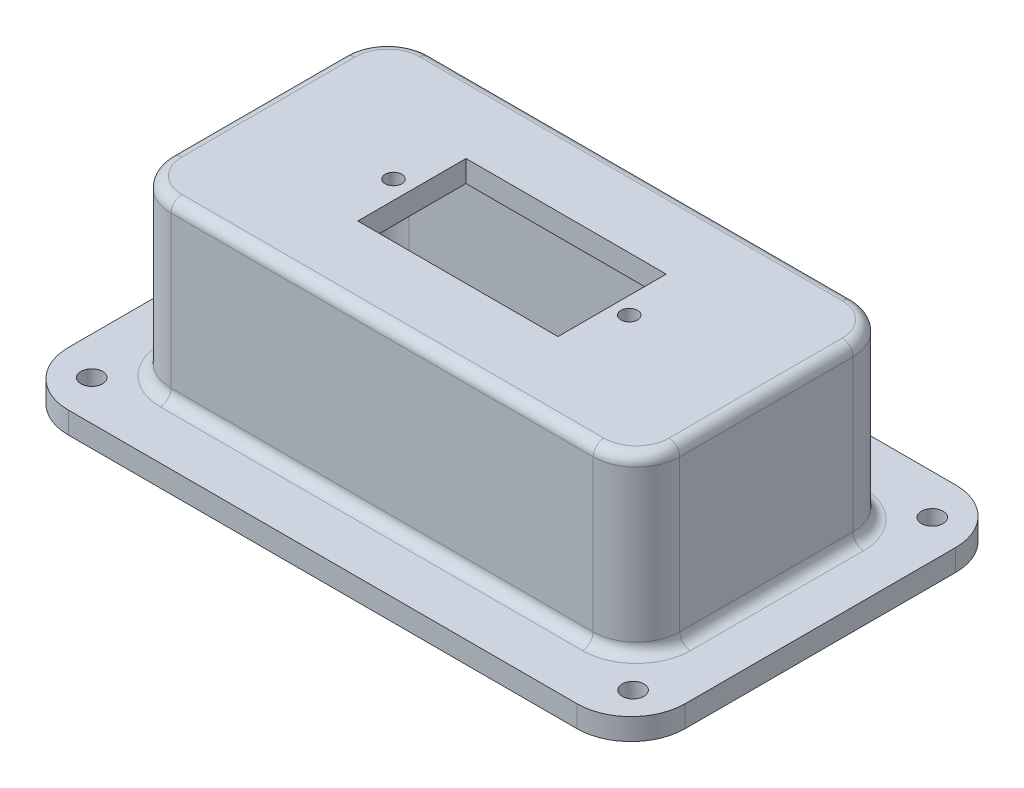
SolidWorks part; units mm, degrees
ref_plane "Front Plane" through (0, 0, 0) normal (0, 0, 1) x (1, 0, 0)
ref_plane "Top Plane" through (0, 0, 0) normal (0, 1, 0) x (1, 0, 0)
ref_plane "Right Plane" through (0, 0, 0) normal (1, 0, 0) x (0, 0, -1)
sketch "Sketch1" plane through (0, 0, 0) normal (0, 1, 0) x (1, 0, 0)
  line L1 (-29.845, 22.225) -> (29.845, 22.225)
  line L2 (-36.195, 15.875) -> (-36.195, -15.875)
  line L3 (-29.845, -22.225) -> (29.845, -22.225)
  line L4 (36.195, 15.875) -> (36.195, -15.875)
  line L5 (-24.765, 12.7) -> (24.765, 12.7)
  line L6 (-27.305, 10.16) -> (-27.305, -10.16)
  line L7 (-24.765, -12.7) -> (24.765, -12.7)
  line L8 (27.305, 10.16) -> (27.305, -10.16)
  arc A0 (29.845, -22.225) -> (36.195, -15.875) centre (29.845, -15.875) ccw
  arc A1 (36.195, 15.875) -> (29.845, 22.225) centre (29.845, 15.875) ccw
  arc A2 (-29.845, 22.225) -> (-36.195, 15.875) centre (-29.845, 15.875) ccw
  arc A3 (-36.195, -15.875) -> (-29.845, -22.225) centre (-29.845, -15.875) ccw
  arc A4 (-27.305, -10.16) -> (-24.765, -12.7) centre (-24.765, -10.16) ccw
  arc A5 (27.305, -10.16) -> (24.765, -12.7) centre (24.765, -10.16) cw
  arc A6 (27.305, 10.16) -> (24.765, 12.7) centre (24.765, 10.16) ccw
  arc A7 (-24.765, 12.7) -> (-27.305, 10.16) centre (-24.765, 10.16) ccw
  point P4 (0, 22.225)
  point P5 (-36.195, 0)
  point P9 (36.195, -22.225)
  point P14 (-36.195, 22.225)
  point P17 (-36.195, -22.225)
  point P22 (0, -12.7)
  point P23 (-27.305, 0)
  point P26 (-27.305, -12.7)
  point P29 (27.305, -12.7)
  point P34 (-27.305, 12.7)
  dimension "D3" = 6.35
  dimension "D6" = 2.54
  dimension "D1" = 44.45
  dimension "D2" = 72.39
  dimension "D4" = 25.4
  dimension "D5" = 54.61
extrude "Boss-Extrude1" add sketch "Sketch1" along normal blind 2.54
sketch "Sketch2" plane through (0, 2.54, 0) normal (0, 1, 0) x (1, 0, 0)
  line L0 (-24.765, -12.7) -> (24.765, -12.7) construction
  line L1 (27.305, -10.16) -> (27.305, 10.16) construction
  line L2 (24.765, 12.7) -> (-24.765, 12.7) construction
  line L3 (-27.305, 10.16) -> (-27.305, -10.16) construction
  line L4 (-24.765, -12.7) -> (24.765, -12.7)
  line L5 (27.305, -10.16) -> (27.305, 10.16)
  line L6 (24.765, 12.7) -> (-24.765, 12.7)
  line L7 (-27.305, 10.16) -> (-27.305, -10.16)
  line L8 (-29.845, 10.16) -> (-29.845, -10.16)
  line L9 (-24.765, -15.24) -> (24.765, -15.24)
  line L10 (29.845, -10.16) -> (29.845, 10.16)
  line L11 (24.765, 15.24) -> (-24.765, 15.24)
  arc A0 (-27.305, -10.16) -> (-24.765, -12.7) centre (-24.765, -10.16) ccw construction
  arc A1 (24.765, -12.7) -> (27.305, -10.16) centre (24.765, -10.16) ccw construction
  arc A2 (27.305, 10.16) -> (24.765, 12.7) centre (24.765, 10.16) ccw construction
  arc A3 (-24.765, 12.7) -> (-27.305, 10.16) centre (-24.765, 10.16) ccw construction
  arc A4 (-27.305, -10.16) -> (-24.765, -12.7) centre (-24.765, -10.16) ccw
  arc A5 (24.765, -12.7) -> (27.305, -10.16) centre (24.765, -10.16) ccw
  arc A6 (27.305, 10.16) -> (24.765, 12.7) centre (24.765, 10.16) ccw
  arc A7 (-24.765, 12.7) -> (-27.305, 10.16) centre (-24.765, 10.16) ccw
  arc A8 (-29.845, -10.16) -> (-24.765, -15.24) centre (-24.765, -10.16) ccw
  arc A9 (24.765, -15.24) -> (29.845, -10.16) centre (24.765, -10.16) ccw
  arc A10 (29.845, 10.16) -> (24.765, 15.24) centre (24.765, 10.16) ccw
  arc A11 (-24.765, 15.24) -> (-29.845, 10.16) centre (-24.765, 10.16) ccw
  dimension "D1" = 2.54
extrude "Boss-Extrude2" add sketch "Sketch2" along normal blind 17.78
sketch "Sketch3" plane through (0, 20.32, 0) normal (0, 1, 0) x (1, 0, 0)
  line L4 (-29.845, 10.16) -> (-29.845, -10.16)
  line L5 (-24.765, -15.24) -> (24.765, -15.24)
  line L6 (29.845, -10.16) -> (29.845, 10.16)
  line L7 (24.765, 15.24) -> (-24.765, 15.24)
  line L8 (-29.845, 10.16) -> (-29.845, -10.16)
  line L9 (-24.765, -15.24) -> (24.765, -15.24)
  line L10 (29.845, -10.16) -> (29.845, 10.16)
  line L11 (24.765, 15.24) -> (-24.765, 15.24)
  arc A4 (-24.765, 15.24) -> (-29.845, 10.16) centre (-24.765, 10.16) ccw
  arc A5 (-29.845, -10.16) -> (-24.765, -15.24) centre (-24.765, -10.16) ccw
  arc A6 (24.765, -15.24) -> (29.845, -10.16) centre (24.765, -10.16) ccw
  arc A7 (29.845, 10.16) -> (24.765, 15.24) centre (24.765, 10.16) ccw
  arc A8 (-24.765, 15.24) -> (-29.845, 10.16) centre (-24.765, 10.16) ccw
  arc A9 (-29.845, -10.16) -> (-24.765, -15.24) centre (-24.765, -10.16) ccw
  arc A10 (24.765, -15.24) -> (29.845, -10.16) centre (24.765, -10.16) ccw
  arc A11 (29.845, 10.16) -> (24.765, 15.24) centre (24.765, 10.16) ccw
  dimension "D1" = 0
extrude "Boss-Extrude3" add sketch "Sketch3" along normal blind 2.54
sketch "Sketch4" plane through (0, 22.86, 0) normal (0, 1, 0) x (1, 0, 0)
  line L1 (-11.7475, -6.35) -> (11.7475, -6.35)
  line L2 (-11.7475, -6.35) -> (-11.7475, 6.35)
  line L3 (-11.7475, 6.35) -> (11.7475, 6.35)
  line L4 (11.7475, -6.35) -> (11.7475, 6.35)
  point P4 (0, -6.35)
  point P5 (-11.7475, 0)
  dimension "D1" = 12.7
  dimension "D2" = 23.495
extrude "Cut-Extrude1" cut sketch "Sketch4" against normal through all
fillet "Fillet1" radius 1.27 16 edges at (28.3571, 22.86, 13.7521) (0, 22.86, 15.24) (-28.3571, 22.86, 13.7521) (-29.845, 22.86, 0) (-28.3571, 22.86, -13.7521) (0, 22.86, -15.24) (28.3571, 22.86, -13.7521) (-28.3571, 2.54, 13.7521) (-29.845, 2.54, 0) (-28.3571, 2.54, -13.7521) (0, 2.54, -15.24) (28.3571, 2.54, -13.7521) (29.845, 2.54, 0) (28.3571, 2.54, 13.7521) (29.845, 22.86, 0) (0, 2.54, 15.24)
sketch "Sketch5" plane through (0, 22.86, 0) normal (0, 1, 0) x (1, 0, 0)
  circle A0 centre (-13.92, 0.0112) radius 0.975
  circle A1 centre (13.75, 0.0112) radius 0.975
extrude "Cut-Extrude2" cut sketch "Sketch5" against normal through all
sketch "Sketch6" plane through (-29.845, 0, 0) normal (-1, 0, 0) x (0, 0, 1)
  line L0 (0, 0) -> (0, 6.35)
  line L2 (6.35, 7.62) -> (-6.35, 7.62)
  line L3 (6.35, 7.62) -> (6.35, 5.08)
  line L4 (6.35, 5.08) -> (-6.35, 5.08)
  line L5 (-6.35, 7.62) -> (-6.35, 5.08)
  point P7 (0, 7.62)
  point P8 (6.35, 6.35)
  dimension "D1" = 6.35
  dimension "D2" = 2.54
  dimension "D3" = 12.7
extrude "Cut-Extrude3" cut sketch "Sketch6" against normal up to surface (2.54 mm away)
sketch "Sketch7" plane through (0, 2.54, 0) normal (0, 1, 0) x (1, 0, 0)
  line L0 (-27.4591, -12.8541) -> (-34.3351, -20.3651) construction
  line L1 (-36.195, 0) -> (36.195, 0) construction
  line L2 (-36.195, 15.875) -> (-36.195, -15.875) construction
  line L3 (36.195, -15.875) -> (36.195, 15.875) construction
  line L4 (0, -22.225) -> (0, 22.225) construction
  line L5 (-29.845, -22.225) -> (29.845, -22.225) construction
  line L6 (29.845, 22.225) -> (-29.845, 22.225) construction
  circle A0 centre (-31.7625, -17.5549) radius 1.27
  arc A2 (-28.575, -10.16) -> (-24.765, -13.97) centre (-24.765, -10.16) ccw construction
  arc A3 (-36.195, -15.875) -> (-29.845, -22.225) centre (-29.845, -15.875) ccw construction
  circle A4 centre (-31.7625, 17.5549) radius 1.27
  circle A5 centre (31.7625, 17.5549) radius 1.27
  circle A6 centre (31.7625, -17.5549) radius 1.27
  dimension "D1" = 2.54
  dimension "D2" = 3.81
extrude "Cut-Extrude4" cut sketch "Sketch7" against normal blind 2.54
